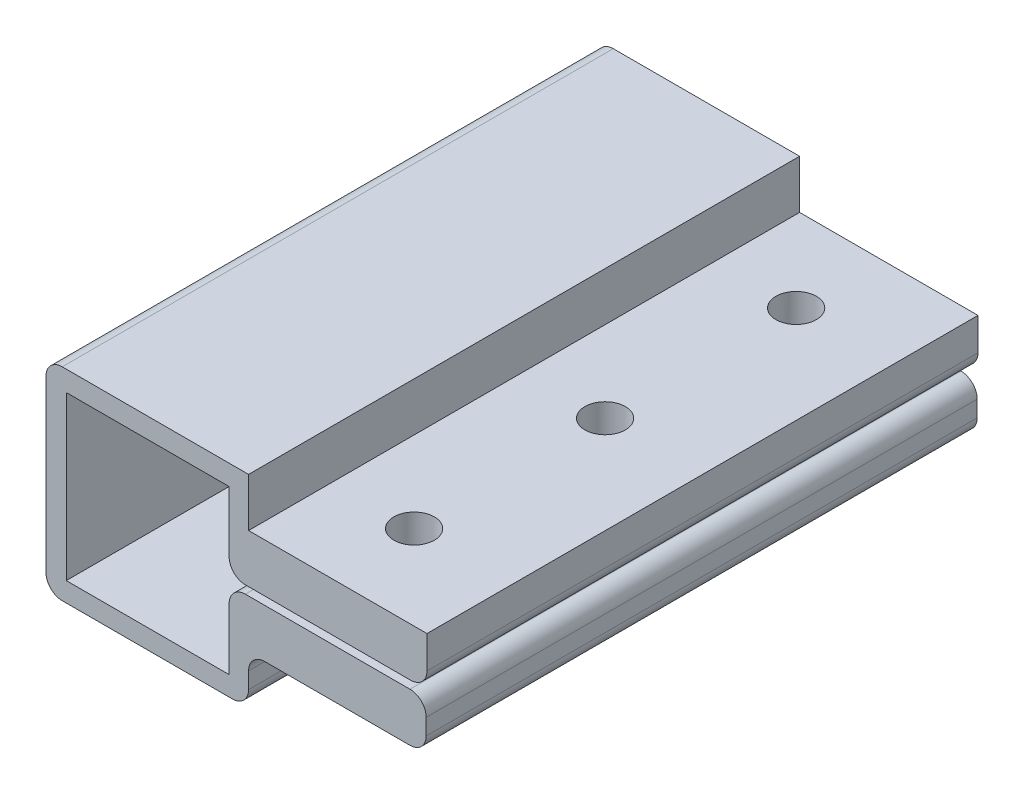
SolidWorks part; units mm, degrees
ref_plane "Front Plane" through (0, 0, 0) normal (0, 0, 1) x (1, 0, 0)
ref_plane "Top Plane" through (0, 0, 0) normal (0, 1, 0) x (1, 0, 0)
ref_plane "Right Plane" through (0, 0, 0) normal (1, 0, 0) x (0, 0, -1)
sketch "Sketch1" plane through (0, 0, 0) normal (0, 0, 1) x (1, 0, 0)
  line L0 (-214.9422, 9.1986) -> (-192.9258, 9.1986)
  line L1 (-192.9258, 9.1986) -> (-192.9258, 5.1986)
  line L2 (-215.3422, 3.1986) -> (-194.9258, 3.1986)
  line L3 (-214.9422, 9.1986) -> (-214.9422, 15.1986)
  line L4 (-214.9422, 15.1986) -> (-237.9422, 15.1986)
  line L5 (-239.9422, 13.1986) -> (-239.9422, -7.8014)
  line L6 (-237.9422, -9.8014) -> (-216.9422, -9.8014)
  line L8 (-217.3422, 5.1986) -> (-217.3422, 12.6986)
  line L9 (-215.3422, 2.1986) -> (-195.0258, 2.1986)
  line L11 (-193.0258, 0.1986) -> (-193.0258, -1.8014)
  line L12 (-237.4422, -7.4014) -> (-217.3422, -7.4014)
  line L13 (-237.4422, -7.4014) -> (-237.4422, 12.6986)
  line L14 (-237.4422, 12.6986) -> (-217.3422, 12.6986)
  line L15 (-217.3422, -7.4014) -> (-217.3422, 0.1986)
  line L16 (-237.4422, -7.4014) -> (-217.3422, 12.6986) construction
  line L17 (-237.4422, 12.6986) -> (-217.3422, -7.4014) construction
  line L18 (-214.9422, -7.8014) -> (-214.9422, -5.8014)
  line L19 (-212.9422, -3.8014) -> (-195.0258, -3.8014)
  arc A0 (-212.9422, -3.8014) -> (-214.9422, -5.8014) centre (-212.9422, -5.8014) ccw
  arc A1 (-195.0258, -3.8014) -> (-193.0258, -1.8014) centre (-195.0258, -1.8014) ccw
  arc A2 (-194.9258, 3.1986) -> (-192.9258, 5.1986) centre (-194.9258, 5.1986) ccw
  arc A3 (-193.0258, 0.1986) -> (-195.0258, 2.1986) centre (-195.0258, 0.1986) ccw
  arc A4 (-216.9422, -9.8014) -> (-214.9422, -7.8014) centre (-216.9422, -7.8014) ccw
  arc A5 (-237.9422, -9.8014) -> (-239.9422, -7.8014) centre (-237.9422, -7.8014) cw
  arc A6 (-237.9422, 15.1986) -> (-239.9422, 13.1986) centre (-237.9422, 13.1986) ccw
  arc A7 (-215.3422, 2.1986) -> (-217.3422, 0.1986) centre (-215.3422, 0.1986) ccw
  arc A8 (-215.3422, 3.1986) -> (-217.3422, 5.1986) centre (-215.3422, 5.1986) cw
  point P34 (-217.3422, 3.1986)
  dimension "D1" = 2
  dimension "D2" = 2
  dimension "D3" = 2
  dimension "D4" = 2
  dimension "D5" = 2
  dimension "D6" = 2
  dimension "D7" = 2
  dimension "D8" = 2
  dimension "D9" = 2
extrude "Boss-Extrude1" add sketch "Sketch1" against normal up to surface (68.0006 mm away)
sketch "Sketch2" plane through (0, 9.1986, 0) normal (0, 1, 0) x (-1, 0, 0)
  circle A0 centre (204.9422, -57.575) radius 2.5
  circle A1 centre (204.9422, -34.0003) radius 2.5
  circle A2 centre (204.9422, -10.4256) radius 2.5
extrude "Cut-Extrude1" cut sketch "Sketch2" against normal blind 20
